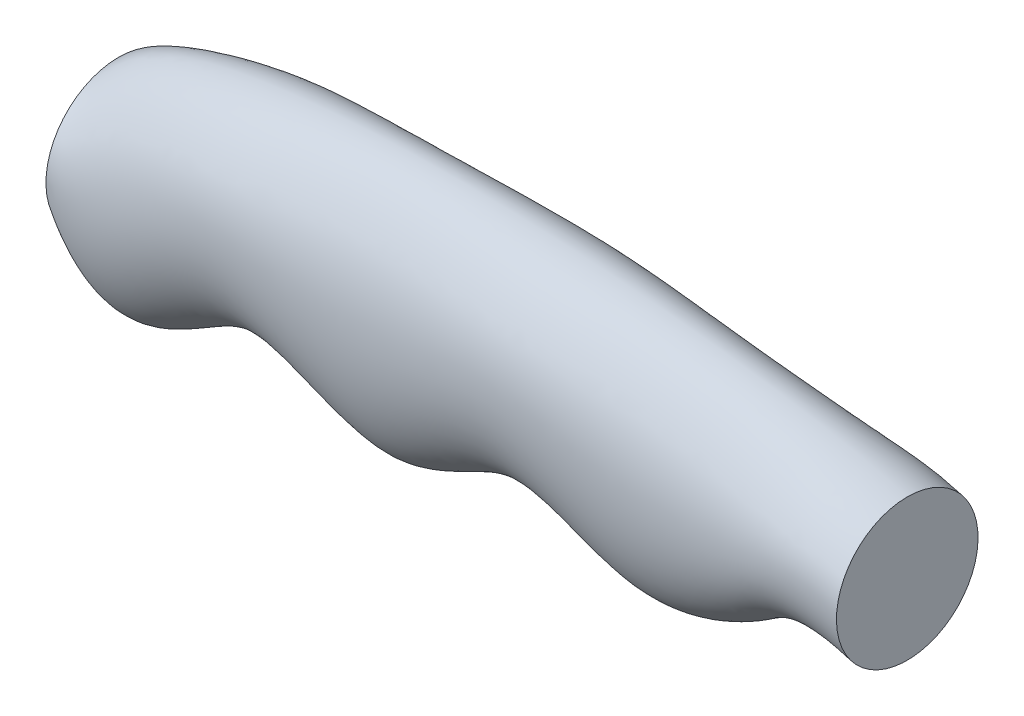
SolidWorks part; units mm, degrees
ref_plane "Vorne (xy)" through (0, 0, 0) normal (0, 0, 1) x (1, 0, 0)
ref_plane "Oben (zx)" through (0, 0, 0) normal (0, 1, 0) x (1, 0, 0)
ref_plane "Rechts (yz)" through (0, 0, 0) normal (1, 0, 0) x (0, 0, -1)
sketch "Skizze1" plane through (0, 0, 0) normal (0, 0, 1) x (1, 0, 0)
  line L0 (0, 0) -> (0, 7.6456) construction
  line L1 (0, 0) -> (0, -13.4579) construction
  spline S0 degree 3 poles (0, 7.6456) (17.3372, 22.4404) (90.6695, 16.7355) (114.7358, 9.634) knots 0 0 0 0 1 1 1 1 construction
  spline S1 degree 3 poles (0, -13.4579) (5.4515, -30.5403) (22.1145, -3.7984) (44.2786, -26.4897) (62.4684, -8.2317) (79.7618, -22.0909) (97.8515, -14.455) (104.4964, -7.6919) (114.7358, -10.9605) knots 0 0 0 0 0.246939 0.415707 0.580167 0.72497 0.875413 1 1 1 1
sketch "Skizze2" plane through (0, 0, 0) normal (1, 0, 0) x (0, 0, -1)
  line L0 (0, 0) -> (0, 7.6456) construction
  line L1 (0, 0) -> (0, -13.4579) construction
  line L2 (0, 7.6456) -> (9.312, 7.6456) construction
  line L3 (0, -13.4579) -> (11.0851, -13.4579) construction
  arc A0 (0, 7.6456) -> (0, -13.4579) centre (0, -2.9061) ccw construction
  circle A1 centre (0, -2.9061) radius 10.5517
  dimension "D1" = 10.5517
ref_plane "Ebene1" through (114.7358, 0, 0) normal (1, 0, 0) x (0, 0, -1)
sketch "Skizze3" plane through (114.7358, 0, 0) normal (1, 0, 0) x (0, 0, -1)
  line L0 (0, 9.634) -> (4.2466, 9.634) construction
  arc A0 (0, 9.634) -> (0, -10.9605) centre (0, -0.6632) ccw construction
  circle A1 centre (0, -0.6632) radius 10.2973
sketch "Skizze4" plane through (0, 0, 0) normal (0, 0, 1) x (1, 0, 0)
  spline S0 degree 3 poles (1899.2114, -612.3358) (-2333.8881, 513.7023) (2492.7294, -325.9322) (-1877.2238, 181.9424) knots -2.235511 -2.235511 -2.235511 -2.235511 3.341243 3.341243 3.341243 3.341243 only from (0, 7.6456) to (114.7358, 9.634) construction
  spline S1 degree 3 poles (0, 7.6456) (17.3372, 22.4404) (90.6695, 16.7355) (114.7358, 9.634) knots 0 0 0 0 1 1 1 1
loft "Ausformung1" add profiles "Skizze3", "Skizze2"
